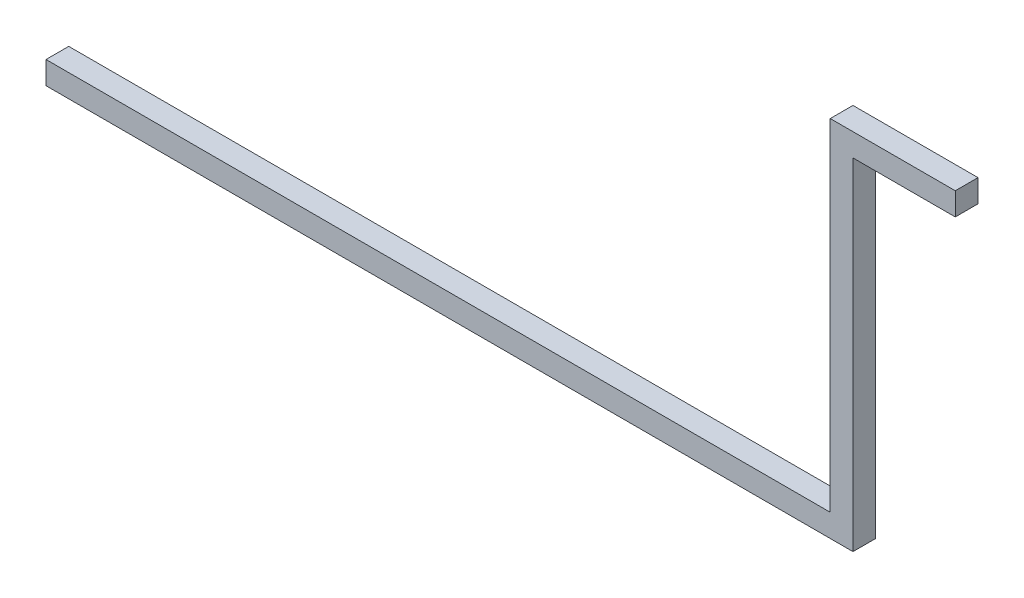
SolidWorks part; units mm, degrees
ref_plane "Front Plane" through (0, 0, 0) normal (0, 0, 1) x (1, 0, 0)
ref_plane "Top Plane" through (0, 0, 0) normal (0, 1, 0) x (1, 0, 0)
ref_plane "Right Plane" through (0, 0, 0) normal (1, 0, 0) x (0, 0, -1)
sketch "Sketch1" plane through (0, 0, 0) normal (0, 0, 1) x (1, 0, 0)
  line L0 (-400, 0) -> (-50, 0)
  line L1 (-50, 0) -> (-50, 150)
  line L2 (-50, 150) -> (0, 150)
  point P3 (0, 0)
  dimension "D1" = 400
  dimension "D2" = 350
  dimension "D3" = 150
  dimension "D4" = 90
extrude "Extrude-Thin1" add sketch "Sketch1" along normal blind 10 thin
